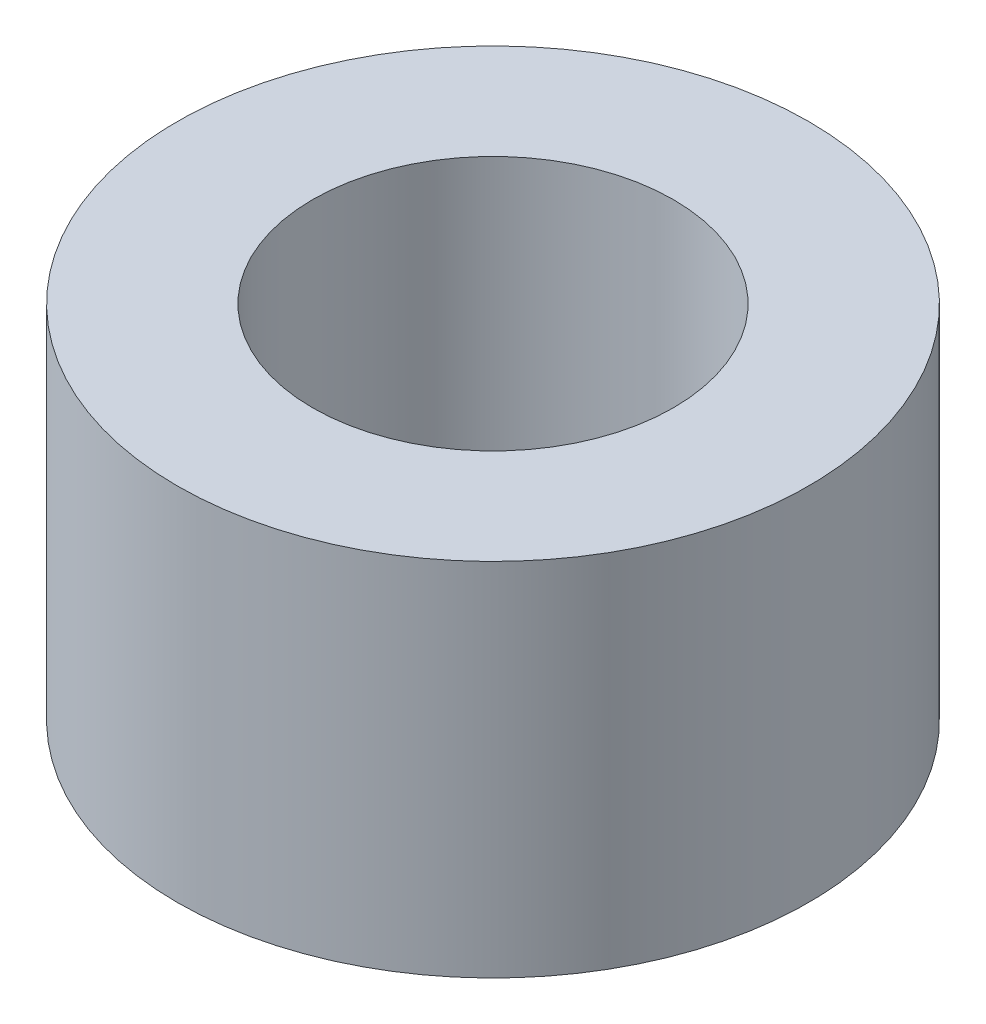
SolidWorks part; units mm, degrees
ref_plane "前视基准面" through (0, 0, 0) normal (0, 0, 1) x (1, 0, 0)
ref_plane "上视基准面" through (0, 0, 0) normal (0, 1, 0) x (1, 0, 0)
ref_plane "右视基准面" through (0, 0, 0) normal (1, 0, 0) x (0, 0, -1)
sketch "草图1" plane through (0, 0, 0) normal (0, 1, 0) x (1, 0, 0)
  circle A0 centre (-9.6651, 11.515) radius 3.5
  circle A1 centre (-9.6651, 11.515) radius 2
extrude "凸台-拉伸1" add sketch "草图1" along normal blind 4
